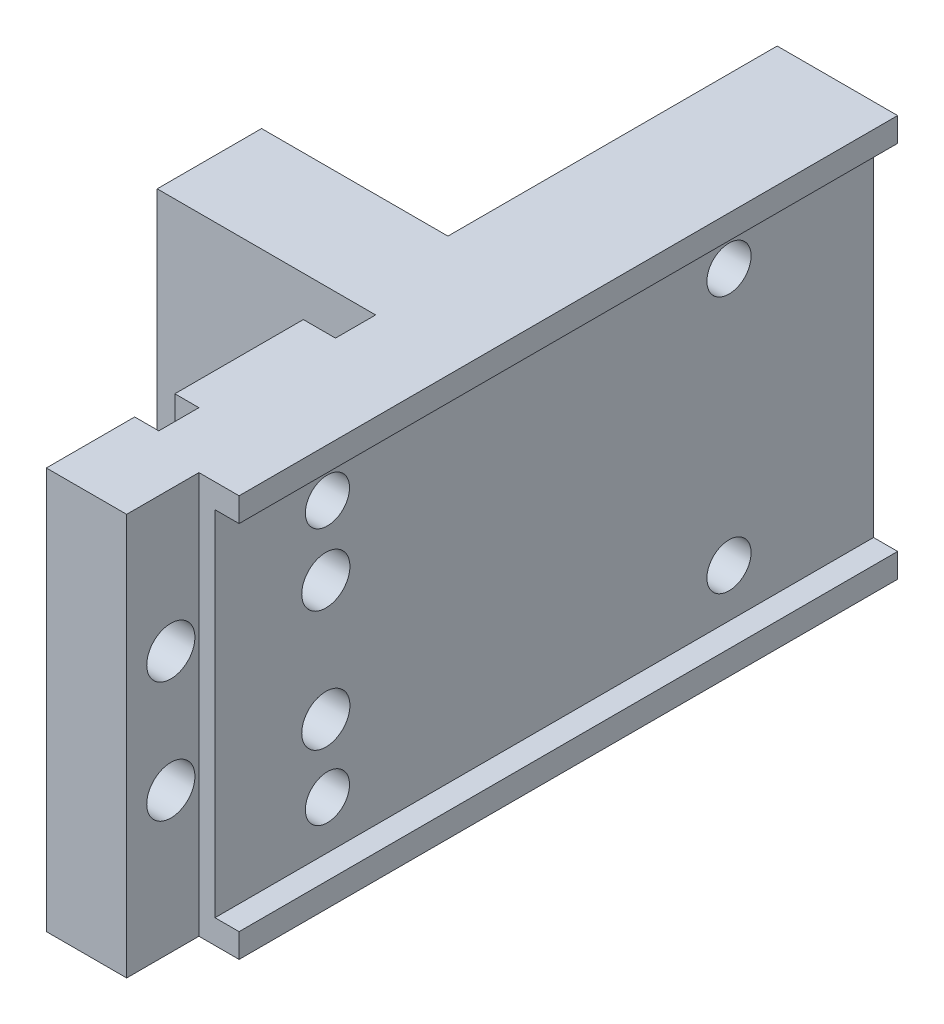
SolidWorks part; units mm, degrees
ref_plane "Ebene vorne" through (0, 0, 0) normal (0, 0, 1) x (1, 0, 0)
ref_plane "Ebene oben" through (0, 0, 0) normal (0, 1, 0) x (1, 0, 0)
ref_plane "Ebene rechts" through (0, 0, 0) normal (1, 0, 0) x (0, 0, -1)
sketch "Skizze1" plane through (0, 0, 0) normal (0, 1, 0) x (1, 0, 0)
  line L0 (-15, 41) -> (0, 41)
  line L1 (0, 41) -> (0, -41)
  line L2 (0, -41) -> (-5, -41)
  line L3 (-5, -41) -> (-5, -50)
  line L4 (-5, -50) -> (-15, -50)
  line L5 (-15, -50) -> (-15, -39)
  line L6 (-15, -39) -> (-12, -39)
  line L7 (-12, -39) -> (-12, -34)
  line L8 (-15, -34) -> (-15, -18)
  line L9 (-15, -18) -> (-11, -18)
  line L10 (-11, -18) -> (-11, -13)
  line L11 (-11, -13) -> (-38.2, -13)
  line L12 (-38.2, -13) -> (-38.2, 0)
  line L13 (-38.2, 0) -> (-15, 0)
  line L14 (-15, 0) -> (-15, 41)
  line L15 (-12, -34) -> (-15, -34)
  dimension "D1" = 82
  dimension "D2" = 91
  dimension "D3" = 10
  dimension "D4" = 15
  dimension "D5" = 11
  dimension "D6" = 16
  dimension "D7" = 3
  dimension "D8" = 32
  dimension "D9" = 37
  dimension "D10" = 11
  dimension "D11" = 38.2
  dimension "D12" = 13
  dimension "D13" = 15
extrude "Linear austragen1" add sketch "Skizze1" along normal mid plane 50
sketch "Skizze2" plane through (0, 0, -41) normal (0, 0, -1) x (-1, 0, 0)
  line L0 (0, 25) -> (0, -25) construction
  line L1 (0, 22) -> (3, 22)
  line L2 (0, 22) -> (0, -22)
  line L3 (0, -22) -> (3, -22)
  line L4 (3, 22) -> (3, -22)
  line L5 (0, 0) -> (38.2, 0) construction
  line L6 (38.2, 25) -> (38.2, -25) construction
  dimension "D1" = 44
  dimension "D2" = 3
extrude "Schnitt-Linear austragen1" cut sketch "Skizze2" against normal up to next
sketch "Skizze3" plane through (-15, 0, 0) normal (-1, 0, 0) x (0, 0, 1)
  line L0 (-41, 25) -> (-41, -25) construction
  line L1 (-41, 22) -> (-6, 22)
  line L2 (-41, 22) -> (-41, -22)
  line L3 (-41, -22) -> (-6, -22)
  line L4 (0, 16) -> (0, -16)
  line L5 (0, 25) -> (0, -25) construction
  line L6 (0, 0) -> (50, 0) construction
  line L7 (50, 25) -> (50, -25) construction
  arc A0 (-6, 22) -> (0, 16) centre (-6, 16) cw
  arc A1 (-6, -22) -> (0, -16) centre (-6, -16) ccw
  point P17 (0, -22)
  dimension "D2" = 6
  dimension "D3" = 6
  dimension "D1" = 44
extrude "Schnitt-Linear austragen2" cut sketch "Skizze3" against normal blind 5
hole_wizard "Ø16.5 (16.5) Durchmesser Bohrung1" positions "Skizze5" profile "Skizze6" hole size "Ø16.5" standard "Ansi Metrisch"
sketch "Skizze5" plane through (0, 0, 0) normal (0, 0, -1) x (-1, 0, 0)
  line L0 (38.2, 25) -> (38.2, -25) construction
  point P0 (24.7, 0)
  dimension "D1" = 13.5
sketch "Skizze6" plane through (-24.7, 0, 0) normal (1, 0, 0) x (0, 1, 0)
  line L0 (0, 0) -> (0, 13)
  line L1 (0, 13) -> (8.25, 13)
  line L2 (8.25, 13) -> (8.25, 0)
  line L5 (8.25, 0) -> (0, 0)
  line L11 (0, -6.35) -> (0, 107.95) construction
  dimension "Bohrerdurchmesser" = 16.5
  dimension "Bohrungstiefe" = 13
sketch "Skizze7" plane through (0, 0, 0) normal (0, 0, -1) x (-1, 0, 0)
  line L0 (15, -25) -> (38.2, -25) construction
  line L1 (24.2, 0) -> (25.2, 0)
  line L2 (24.2, 0) -> (24.2, -25)
  line L3 (24.2, -25) -> (25.2, -25)
  line L4 (25.2, 0) -> (25.2, -25)
  line L5 (24.7, 0) -> (24.7, 25) construction
  line L6 (15, 25) -> (38.2, 25) construction
  dimension "D1" = 1
extrude "Schnitt-Linear austragen3" cut sketch "Skizze7" against normal up to next
hole_wizard "Stirnsenkung für M6 Zylinderschraube mit Innensechskant1" positions "Skizze9" profile "Skizze10" counterbore size "M6" standard "Ansi Metrisch"
sketch "Skizze9" plane through (-38.2, 0, 0) normal (-1, 0, 0) x (0, 0, 1)
  line L0 (6.5, 25) -> (6.5, 0) construction
  line L1 (0, 25) -> (13, 25) construction
  point P0 (6.5, -15)
  dimension "D1" = 15
sketch "Skizze10" plane through (-38.2, -15, 6.5) normal (0, 1, 0) x (0, 0, 1)
  line L0 (0, 0) -> (0, 13)
  line L1 (0, 13) -> (3.3, 13)
  line L3 (3.3, 13) -> (3.3, 6)
  line L4 (3.3, 6) -> (5.5, 6)
  line L5 (5.5, 6) -> (5.5, 0)
  line L7 (5.5, 0) -> (0, 0)
  line L11 (0, -6.35) -> (0, 107.95) construction
  dimension "Bohrerdurchmesser" = 6.6
  dimension "Bohrungstiefe" = 13
  dimension "Senkdurchmesser2" = 11
  dimension "Senktiefe2" = 6
hole_wizard "M6x1.0 Gewindebohrung1" positions "Skizze12" profile "Skizze11" tap size "M6x1.0" standard "Ansi Metrisch"
sketch "Skizze12" plane through (-24.2, 0, 0) normal (-1, 0, 0) x (0, 0, 1)
  circle A0 centre (6.5, -15) radius 3.3 construction
  point P0 (6.5, -15)
sketch "Skizze11" plane through (-24.2, -15, 6.5) normal (0, 1, 0) x (0, 0, 1)
  line L0 (0, 0) -> (0, 16.5022)
  line L1 (0, 16.5022) -> (2.5, 15)
  line L2 (2.5, 15) -> (2.5, 12)
  line L3 (2.5, 12) -> (3, 12)
  line L4 (3, 12) -> (3, 0)
  line L5 (3, 0) -> (0, 0)
  line L10 (0, 16.5022) -> (-2.5, 15) construction
  line L11 (0, -6.35) -> (0, 107.95) construction
  dimension "Bohrerdurchmesser" = 5
  dimension "Bohrungstiefe" = 15
  dimension "Nenndurchmesser" = 6
  dimension "Gewindelänge" = 12
  dimension "Spitzenwinkel" = 118
hole_wizard "Ø5.5 (5.5) Durchmesser Bohrung1" positions "Skizze14" profile "Skizze13" hole size "Ø5.5" standard "Ansi Metrisch"
sketch "Skizze14" plane through (-10, 0, 0) normal (-1, 0, 0) x (0, 0, 1)
  line L0 (0, 0) -> (-41, 0) construction
  line L1 (-41, 22) -> (-41, -22) construction
  point P0 (-23, 16)
  point P1 (-23, -16)
  dimension "D1" = 32
  dimension "D2" = 18
sketch "Skizze13" plane through (-10, 16, -23) normal (0, 1, 0) x (0, 0, 1)
  line L0 (0, 0) -> (0, 7)
  line L1 (0, 7) -> (2.75, 7)
  line L2 (2.75, 7) -> (2.75, 0)
  line L5 (2.75, 0) -> (0, 0)
  line L11 (0, -6.35) -> (0, 107.95) construction
  dimension "Bohrerdurchmesser" = 5.5
  dimension "Bohrungstiefe" = 7
hole_wizard "Stirnsenkung für M5 Zylinderschraube mit Innensechskant1" positions "Skizze16" profile "Skizze17" counterbore size "M5" standard "Ansi Metrisch"
sketch "Skizze16" plane through (-15, 0, 0) normal (-1, 0, 0) x (0, 0, 1)
  line L0 (0, 0) -> (50, 0) construction
  line L1 (50, 25) -> (50, -25) construction
  point P0 (27, 16)
  point P1 (27, -16)
  dimension "D1" = 32
  dimension "D2" = 23
sketch "Skizze17" plane through (-15, 16, 27) normal (0, 1, 0) x (0, 0, 1)
  line L0 (0, 0) -> (0, 15)
  line L1 (0, 15) -> (2.75, 15)
  line L3 (2.75, 15) -> (2.75, 5)
  line L4 (2.75, 5) -> (5, 5)
  line L5 (5, 5) -> (5, 0)
  line L7 (5, 0) -> (0, 0)
  line L11 (0, -6.35) -> (0, 107.95) construction
  dimension "Bohrerdurchmesser" = 5.5
  dimension "Bohrungstiefe" = 15
  dimension "Senkdurchmesser2" = 10
  dimension "Senktiefe2" = 5
hole_wizard "M6x1.0 Gewindebohrung3" positions "Skizze19" profile "Skizze20" tap size "M6x1.0" standard "Ansi Metrisch"
sketch "Skizze19" plane through (-15, 0, 0) normal (-1, 0, 0) x (0, 0, 1)
  line L0 (50, 0) -> (18, 0) construction
  line L1 (50, 25) -> (50, -25) construction
  line L2 (18, 25) -> (18, -25) construction
  point P0 (27.2, 7.5)
  point P1 (44.5, 7.5)
  point P3 (44.5, -7.5)
  point P5 (27.2, -7.5)
  dimension "D1" = 15
  dimension "D2" = 5.5
  dimension "D3" = 22.8
sketch "Skizze20" plane through (-15, 7.5, 27.2) normal (0, 1, 0) x (0, 0, 1)
  line L0 (0, 0) -> (0, 12)
  line L1 (0, 12) -> (3, 12)
  line L2 (3, 12) -> (3, 0)
  line L5 (3, 0) -> (0, 0)
  line L11 (0, -6.35) -> (0, 107.95) construction
  dimension "Nenndurchmesser (Haupt)" = 6
  dimension "Bohrungstiefe" = 12
